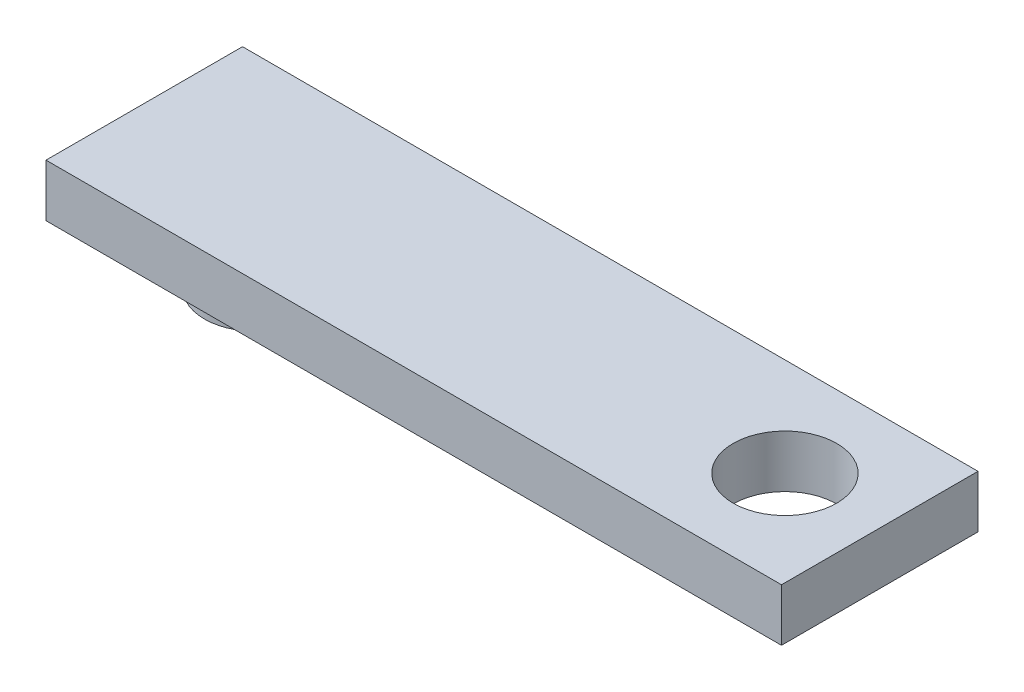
SolidWorks part; units mm, degrees
ref_plane "Ebene vorne" through (0, 0, 0) normal (0, 0, 1) x (1, 0, 0)
ref_plane "Ebene oben" through (0, 0, 0) normal (0, 1, 0) x (1, 0, 0)
ref_plane "Ebene rechts" through (0, 0, 0) normal (1, 0, 0) x (0, 0, -1)
sketch "Skizze1" plane through (0, 0, 0) normal (0, 1, 0) x (1, 0, 0)
  circle A0 centre (0, 0) radius 9.87
extrude "Linear austragen1" add sketch "Skizze1" along normal blind 10
sketch "Skizze2" plane through (0, 10, 0) normal (0, 1, 0) x (1, 0, 0)
  line L0 (-21.3395, 0) -> (0, 0) construction
  line L1 (-21.3395, 18.7289) -> (118.8517, 18.7289)
  line L2 (-21.3395, 18.7289) -> (-21.3395, -18.7289)
  line L3 (-21.3395, -18.7289) -> (118.8517, -18.7289)
  line L4 (118.8517, 18.7289) -> (118.8517, -18.7289)
extrude "Linear austragen2" add sketch "Skizze2" along normal blind 10
sketch "Skizze3" plane through (0, 20, 0) normal (0, 1, 0) x (1, 0, 0)
  circle A0 centre (100.7797, 0) radius 9.87
  circle A1 centre (0, 0) radius 9.87 construction
extrude "Linear austragen3" cut sketch "Skizze3" against normal blind 10
